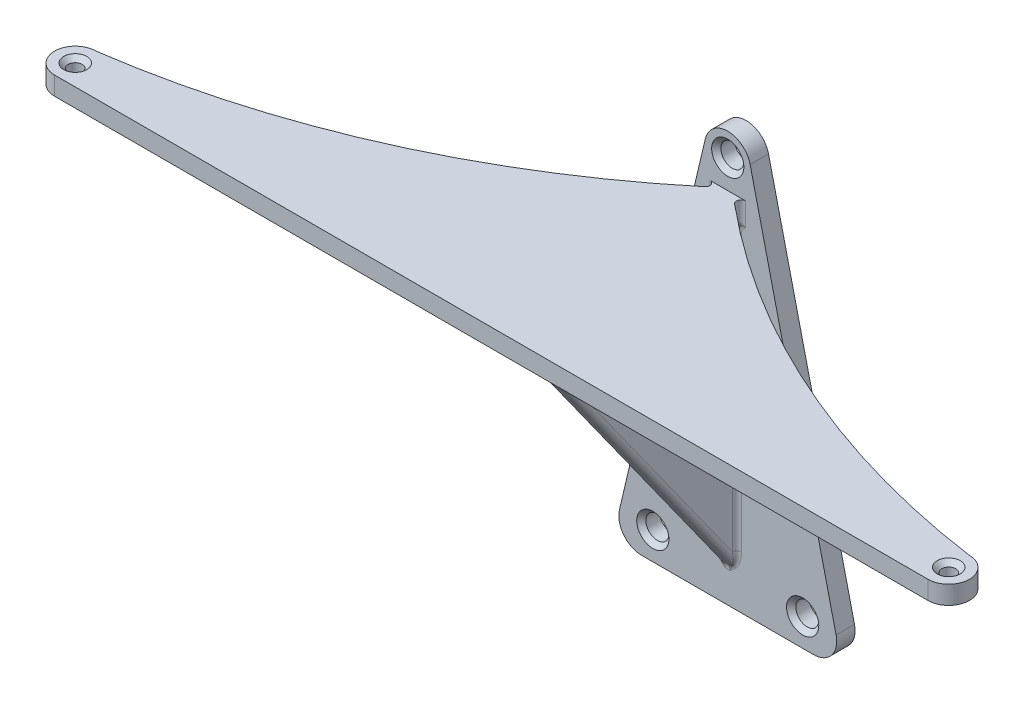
SolidWorks part; units mm, degrees
ref_plane "Alzado" through (0, 0, 0) normal (0, 0, 1) x (1, 0, 0)
ref_plane "Planta" through (0, 0, 0) normal (0, 1, 0) x (1, 0, 0)
ref_plane "Vista lateral" through (0, 0, 0) normal (1, 0, 0) x (0, 0, -1)
sketch "Croquis1" plane through (0, 0, 0) normal (0, 0, 1) x (1, 0, 0)
  line L1 (-18.6836, 0) -> (18.6836, 0)
  line L2 (-4.8665, 85.3661) -> (-23.5501, 6.1478)
  line L3 (4.8665, 85.3661) -> (23.5501, 6.1478)
  line L6 (0, 86.7184) -> (0, 106) construction
  circle A0 centre (-16.2871, 6.0193) radius 2.5
  circle A1 centre (16.2871, 6.0193) radius 2.5
  arc A2 (23.5501, 6.1478) -> (18.6836, 0) centre (18.6836, 5) cw
  arc A3 (-18.6836, 0) -> (-23.5501, 6.1478) centre (-18.6836, 5) cw
  arc A4 (4.8665, 85.3661) -> (-4.8665, 85.3661) centre (0, 84.2184) ccw
  circle A5 centre (0, 84.2184) radius 2.5
  point P13 (25, 0)
  point P16 (-25, 0)
  dimension "D4" = 5
  dimension "D5" = 5
  dimension "D6" = 5
  dimension "D7" = 5
extrude "Saliente-Extruir1" add sketch "Croquis1" along normal blind 4
sketch "Croquis2" plane through (0, 0, 0) normal (1, 0, 0) x (0, 0, -1)
  line L0 (0, 89.2184) -> (-4, 89.2184) construction
  line L1 (-4, 0) -> (0, 0) construction
  line L2 (0, 6.1478) -> (0, 85.3661) construction
  line L3 (-4, 6.1478) -> (-4, 85.3661) construction
  line L4 (0, 89.2184) -> (-4, 89.2184)
  line L5 (-4, 0) -> (0, 0)
  line L6 (0, 6.1478) -> (0, 85.3661)
  line L7 (-4, 6.1478) -> (-4, 78.025)
  line L8 (-4, 6.1478) -> (-55.4, 78.025)
  line L9 (-4, 78.025) -> (-55.4, 78.025)
  dimension "D1" = 51.4
extrude "Saliente-Extruir2" add sketch "Croquis2" along normal mid plane 4 contours L7 L9 L8
sketch "Croquis3" plane through (0, 78.025, 0) normal (0, 1, 0) x (1, 0, 0)
  line L0 (0, -4) -> (0, -55.4) construction
  line L1 (-4.8665, -4) -> (4.8665, -4) construction
  line L2 (2, -55.4) -> (-2, -55.4) construction
  line L4 (94.9355, -56.4) -> (-94.9355, -56.4)
  line L5 (93.4355, -51.9) -> (94.9355, -51.9)
  circle A0 centre (94.9355, -51.9) radius 1.5
  arc A1 (94.9355, -56.4) -> (94.9355, -47.4) centre (94.9355, -51.9) ccw
  arc A2 (0, -4) -> (94.9355, -47.4) centre (120.6171, 134.3108) ccw
  circle A3 centre (94.9355, -51.9) radius 4.5 construction
  arc A4 (-94.9355, -56.4) -> (-94.9355, -47.4) centre (-94.9355, -51.9) cw
  arc A5 (0, -4) -> (-94.9355, -47.4) centre (-120.6171, 134.3108) cw
  circle A6 centre (-94.9355, -51.9) radius 1.5
  point P16 (0, -56.4)
  dimension "D2" = 3
  dimension "D4" = 3
  dimension "D1" = 95
  dimension "D5" = 1
  dimension "D3" = 3
extrude "Saliente-Extruir10" add sketch "Croquis3" against normal blind 4 contours A5 A4 L4 A1 A2 A6 A0 M9 M11 M10 | A2 A5 M9 M10 M11
sketch "Croquis4" plane through (0, 0, 0) normal (0, 0, -1) x (-1, 0, 0)
  line L3 (-18.6836, 0) -> (18.6836, 0)
  line L4 (23.5501, 6.1478) -> (4.8665, 85.3661)
  line L5 (-4.8665, 85.3661) -> (-23.5501, 6.1478)
  line L6 (-18.6836, 0) -> (18.6836, 0)
  line L7 (23.5501, 6.1478) -> (4.8665, 85.3661)
  line L8 (-4.8665, 85.3661) -> (-23.5501, 6.1478)
  arc A3 (-23.5501, 6.1478) -> (-18.6836, 0) centre (-18.6836, 5) ccw
  arc A4 (18.6836, 0) -> (23.5501, 6.1478) centre (18.6836, 5) ccw
  arc A5 (4.8665, 85.3661) -> (-4.8665, 85.3661) centre (0, 84.2184) ccw
  arc A6 (-23.5501, 6.1478) -> (-18.6836, 0) centre (-18.6836, 5) ccw
  arc A7 (18.6836, 0) -> (23.5501, 6.1478) centre (18.6836, 5) ccw
  arc A8 (4.8665, 85.3661) -> (-4.8665, 85.3661) centre (0, 84.2184) ccw
  dimension "D1" = 0
extrude "Cortar-Extruir1" cut sketch "Croquis4" against normal blind 1
sketch "Croquis5" plane through (0, 0, 4) normal (0, 0, 1) x (1, 0, 0)
  line L3 (23.5501, 6.1478) -> (4.8665, 85.3661)
  line L4 (-4.8665, 85.3661) -> (-23.5501, 6.1478)
  line L5 (-18.6836, 0) -> (18.6836, 0)
  line L6 (23.5501, 6.1478) -> (4.8665, 85.3661)
  line L7 (-4.8665, 85.3661) -> (-23.5501, 6.1478)
  line L8 (-18.6836, 0) -> (18.6836, 0)
  circle A0 centre (0, 84.2184) radius 2.5 construction
  circle A1 centre (16.2871, 6.0193) radius 2.5 construction
  circle A2 centre (-16.2871, 6.0193) radius 2.5 construction
  arc A3 (18.6836, 0) -> (23.5501, 6.1478) centre (18.6836, 5) ccw
  arc A4 (4.8665, 85.3661) -> (-4.8665, 85.3661) centre (0, 84.2184) ccw
  arc A5 (-23.5501, 6.1478) -> (-18.6836, 0) centre (-18.6836, 5) ccw
  arc A6 (18.6836, 0) -> (23.5501, 6.1478) centre (18.6836, 5) ccw
  arc A7 (4.8665, 85.3661) -> (-4.8665, 85.3661) centre (0, 84.2184) ccw
  arc A8 (-23.5501, 6.1478) -> (-18.6836, 0) centre (-18.6836, 5) ccw
  circle A9 centre (0, 84.2184) radius 2.5
  circle A10 centre (16.2871, 6.0193) radius 2.5
  circle A11 centre (-16.2871, 6.0193) radius 2.5
  dimension "D1" = 0
extrude "Saliente-Extruir12" add sketch "Croquis5" along normal blind 1
chamfer "Chaflán5" distance 1 angle 45 3 edges at (2.5, 84.2184, 5) (18.7871, 6.0193, 5) (-13.7871, 6.0193, 5)
chamfer "Chaflán6" distance 1 angle 45 2 edges at (-94.9355, 78.025, 53.4) (94.9355, 78.025, 53.4)
fillet "Redondeo33" radius 2.5 2 edges at (2, 76.025, 5.719) (-2, 76.025, 5.719)
fillet "Redondeo34" radius 2.5 1 edges at (-2, 74.025, 28.7698)
fillet "Redondeo35" radius 2.5 1 edges at (2, 74.025, 28.7698)
fillet "Redondeo36" radius 2.5 1 edges at (0, 74.025, 52.5396)
fillet "Redondeo37" radius 2.5 1 edges at (0, 7.5461, 5)
fillet "Redondeo38" radius 1.5 4 edges at (-2, 7.5078, 5.1195) (-3.3567, 73.7482, 52.6819) (-2.1195, 72.2886, 51.2978) (-2, 39.8617, 28.1091)
fillet "Redondeo40" radius 1.5 4 edges at (2, 7.5078, 5.1195) (3.3567, 73.7482, 52.6819) (2.1195, 72.2886, 51.2978) (2, 39.8617, 28.1091)
fillet "Redondeo42" radius 1 4 edges at (-2, 74.775, 5) (-1.9176, 9.2822, 5) (-2, 40.8249, 5)
fillet "Redondeo43" radius 1 4 edges at (2, 74.775, 5) (1.9176, 9.2822, 5) (2, 40.8249, 5)
fillet "Redondeo44" radius 1 4 edges at (47.0047, 74.025, 33.7951) (2.9313, 73.4716, 6.2843) (3.0744, 73.3497, 5.4214)
fillet "Redondeo46" radius 1 4 edges at (-47.0047, 74.025, 33.7951) (-3.7451, 73.9083, 7.1788) (-3.0288, 73.5462, 6.5082) (-3.0744, 73.3497, 5.4214)
